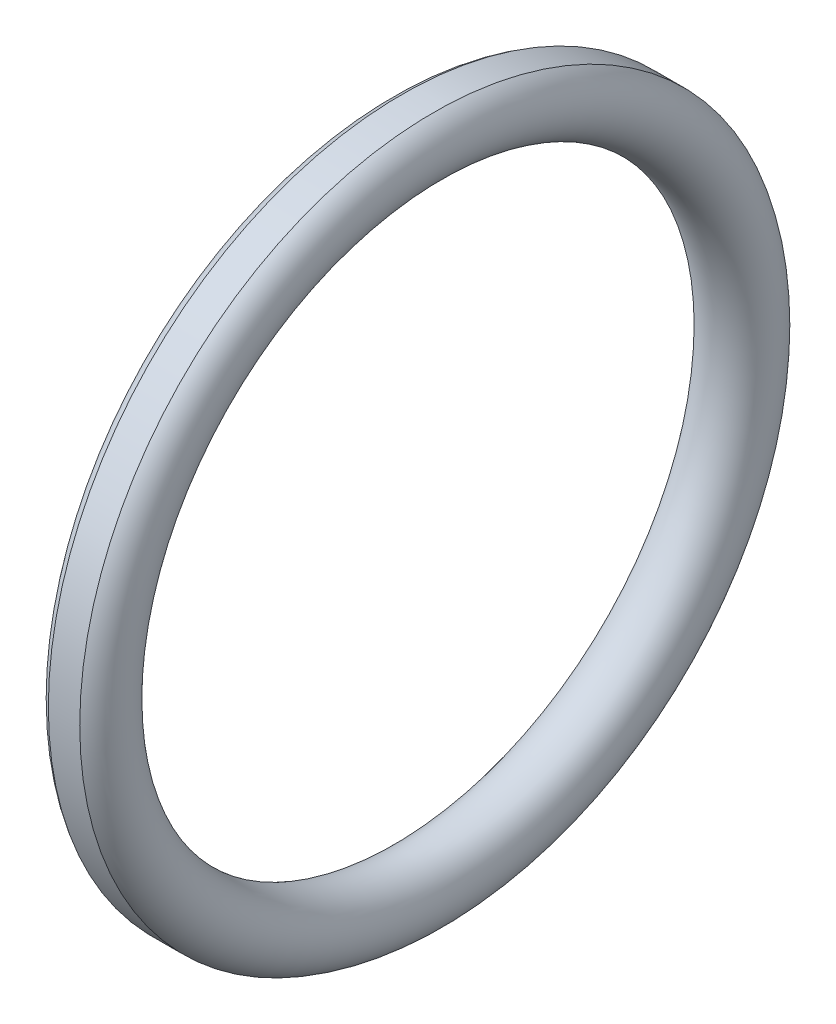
SolidWorks part; units mm, degrees
ref_plane "Plan de face" through (0, 0, 0) normal (0, 0, 1) x (1, 0, 0)
ref_plane "Plan de dessus" through (0, 0, 0) normal (0, 1, 0) x (1, 0, 0)
ref_plane "Plan de droite" through (0, 0, 0) normal (1, 0, 0) x (0, 0, -1)
imported_body "Importée1"
sketch "Esquisse1" plane through (0, 0, 0) normal (0, 1, 0) x (1, 0, 0)
  line L0 (-3.7075, 0) -> (4.3523, 0) construction
  line L1 (-2.734, 18.3) -> (3.4333, 18.3)
  line L2 (-2.734, 18.3) -> (-2.734, 20.7499)
  line L3 (-2.734, 20.7499) -> (3.4333, 20.7499)
  line L4 (3.4333, 18.3) -> (3.4333, 20.7499)
  dimension "D1" = 18.3
revolve "Enlèvement de matière-Révolution1" cut sketch "Esquisse1" angle 360 about L0
